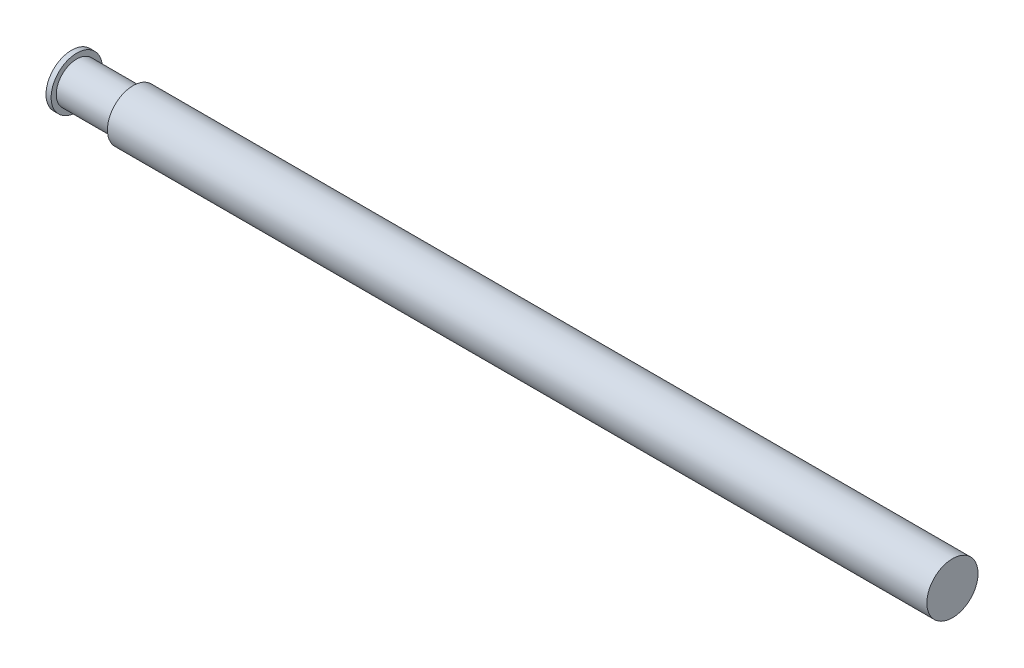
SolidWorks part; units mm, degrees
ref_plane "Plan1" through (0, 0, 0) normal (0, 0, 1) x (1, 0, 0)
ref_plane "Plan2" through (0, 0, 0) normal (0, 1, 0) x (1, 0, 0)
ref_plane "Plan3" through (0, 0, 0) normal (1, 0, 0) x (0, 0, -1)
sketch "Esquisse1" plane through (0, 0, 0) normal (0, 0, 1) x (1, 0, 0)
  line L0 (-87, 0) -> (99, 0) construction
  line L1 (-112, 0) -> (-112, 4)
  line L2 (-111, 4) -> (-100, 4)
  line L3 (-100, 4) -> (-100, 5)
  line L4 (-100, 5) -> (60, 5)
  line L5 (60, 5) -> (60, 0)
  line L6 (-112, 0) -> (60, 0)
  line L7 (-112, 4) -> (-112, 5)
  line L8 (-112, 5) -> (-111, 5)
  line L9 (-111, 5) -> (-111, 4)
  dimension "D1" = 160
  dimension "D2" = 12
  dimension "D3" = 5
  dimension "D4" = 4
revolve "Base-Révolution" add sketch "Esquisse1" angle 360 about L0
other "Perçage1" parameters "D1"=4
sketch "Esquisse2" plane through (-112, 0, 0) normal (-1, 0, 0) x (0, 0, 1)
  circle A0 centre (-0.2213, -0.3018) radius 3
  dimension "D1" = 6
